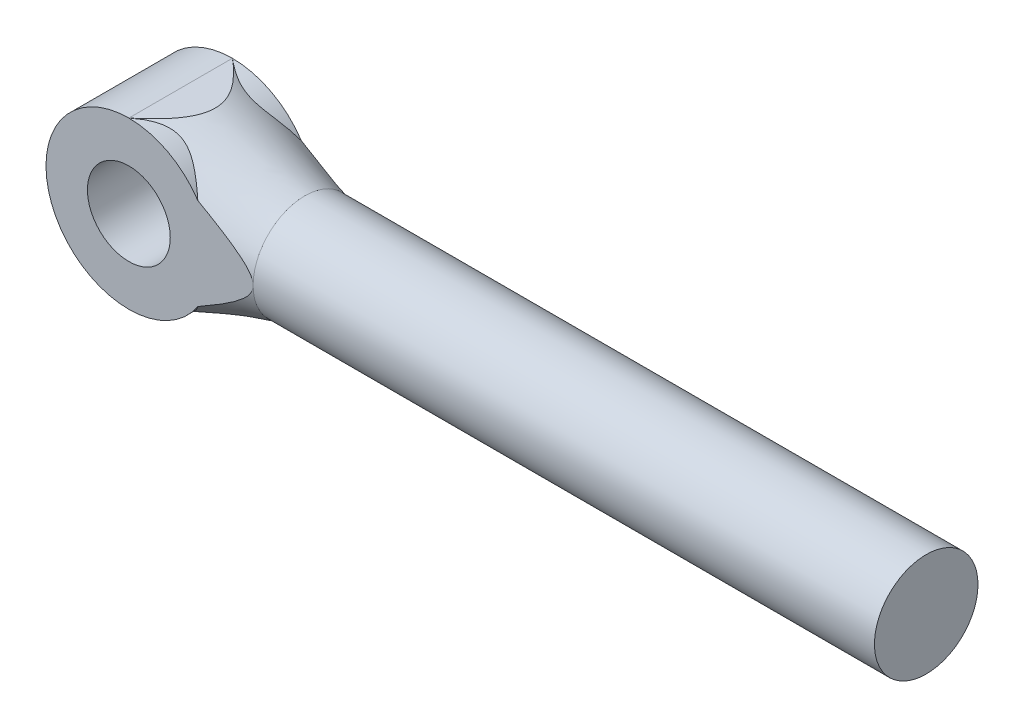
SolidWorks part; units mm, degrees
ref_plane "Plan de face" through (0, 0, 0) normal (0, 0, 1) x (1, 0, 0)
ref_plane "Plan de dessus" through (0, 0, 0) normal (0, 1, 0) x (1, 0, 0)
ref_plane "Plan de droite" through (0, 0, 0) normal (1, 0, 0) x (0, 0, -1)
sketch "Esquisse1" plane through (0, 0, 0) normal (1, 0, 0) x (0, 0, -1)
  circle A0 centre (0, 0) radius 25
extrude "Boss.-Extru.1" add sketch "Esquisse1" along normal blind 300
sketch "Esquisse2" plane through (0, 0, 0) normal (0, 0, 1) x (1, 0, 0)
  circle A0 centre (-60, 0) radius 20
  circle A1 centre (-60, 0) radius 40
extrude "Boss.-Extru.2" add sketch "Esquisse2" along normal mid plane 50 separate body
sketch "Esquisse3" plane through (0, 0, 0) normal (-1, 0, 0) x (0, 0, 1)
  circle A0 centre (0, 0) radius 25
sketch "Esquisse4" plane through (0, 0, 0) normal (0, 0, 1) x (1, 0, 0)
  point P0 (-60, 0)
ref_plane "Plan1" through (-60, 0, 0) normal (1, 0, 0) x (0, 0, -1)
sketch "Esquisse5" plane through (-60, 0, 0) normal (1, 0, 0) x (0, 0, -1)
  circle A0 centre (0, 0) radius 47.1699
loft "Lissage1" add profiles "Esquisse3", "Esquisse5"
sketch "Esquisse6" plane through (-60, 0, 0) normal (-1, 0, 0) x (0, 0, 1)
  line L1 (-25, 40) -> (25, 40)
  line L2 (-25, 40) -> (-25, -40)
  line L3 (-25, -40) -> (25, -40)
  line L4 (25, 40) -> (25, -40)
  line L5 (-74.3349, 65.3569) -> (78.4284, 65.3569)
  line L6 (-74.3349, 65.3569) -> (-74.3349, -65.1345)
  line L7 (-74.3349, -65.1345) -> (78.4284, -65.1345)
  line L8 (78.4284, 65.3569) -> (78.4284, -65.1345)
extrude "Enlèv. mat.-Extru.1" cut sketch "Esquisse6" against normal blind 120
sketch "Esquisse7" plane through (0, 0, 25) normal (0, 0, 1) x (1, 0, 0)
  circle A0 centre (-60, 0) radius 20
extrude "Enlèv. mat.-Extru.2" cut sketch "Esquisse7" against normal through all
